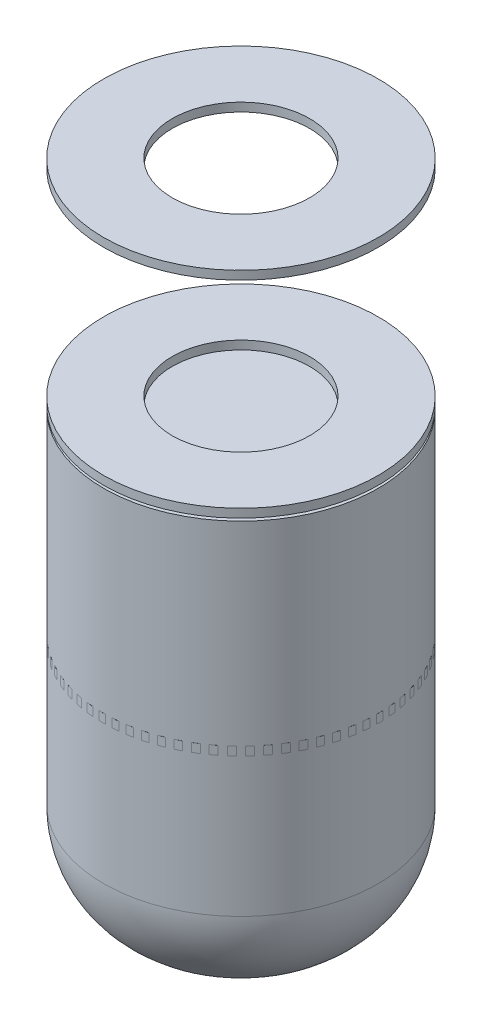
SolidWorks part; units mm, degrees
ref_plane "Front Plane" through (0, 0, 0) normal (0, 0, 1) x (1, 0, 0)
ref_plane "Top Plane" through (0, 0, 0) normal (0, 1, 0) x (1, 0, 0)
ref_plane "Right Plane" through (0, 0, 0) normal (1, 0, 0) x (0, 0, -1)
sketch "Sketch1" plane through (0, 0, 0) normal (0, 0, 1) x (1, 0, 0)
  line L6 (0, 0) -> (-50.8, 0) construction
  line L19 (-46.99, -101.6) -> (0, -101.6) construction
  line L20 (-50.8, 0) -> (0, 0)
  line L31 (0, 164.719) -> (0, 0) construction
  line L34 (-50.8, -126.619) -> (-50.8, -115.6271)
  line L35 (0, -164.719) -> (-12.7, -164.719)
  line L39 (-50.8, -115.6271) -> (-50.8, 0)
  line L40 (0, 0) -> (0, -164.719)
  arc A7 (-12.7, -164.719) -> (-50.8, -126.619) centre (-12.7, -126.619) cw
  point P0 (0, 0)
  dimension "D6" = 101.6
revolve "Revolve2" add sketch "Sketch1" angle 360 about L31
ref_plane "Plane1" through (0, 2.54, 0) normal (0, 1, 0) x (1, 0, 0)
sketch "Sketch2" plane through (0, 2.54, 0) normal (0, 1, 0) x (1, 0, 0)
  circle A1 centre (0, 0) radius 50.8
  circle A2 centre (0, 0) radius 25.4
  dimension "D1" = 101.6
  dimension "D2" = 50.8
extrude "Boss-Extrude1" add sketch "Sketch2" along normal mid plane 3.175
ref_plane "Plane2" through (0, 78.74, 0) normal (0, 1, 0) x (1, 0, 0)
sketch "Sketch3" plane through (0, 78.74, 0) normal (0, 1, 0) x (1, 0, 0)
  circle A1 centre (0, 0) radius 50.8
  circle A2 centre (0, 0) radius 25.4
  dimension "D1" = 50.8
extrude "Boss-Extrude2" add sketch "Sketch3" along normal mid plane 3.175
ref_plane "Plane3" through (0, -73.66, 0) normal (0, 1, 0) x (1, 0, 0)
sketch "Sketch4" plane through (0, -73.66, 0) normal (0, 1, 0) x (1, 0, 0)
  circle A1 centre (0, 0) radius 50.8
  circle A2 centre (0, 0) radius 25.4
  dimension "D1" = 50.8
extrude "Boss-Extrude3" add sketch "Sketch4" along normal mid plane 3.175
